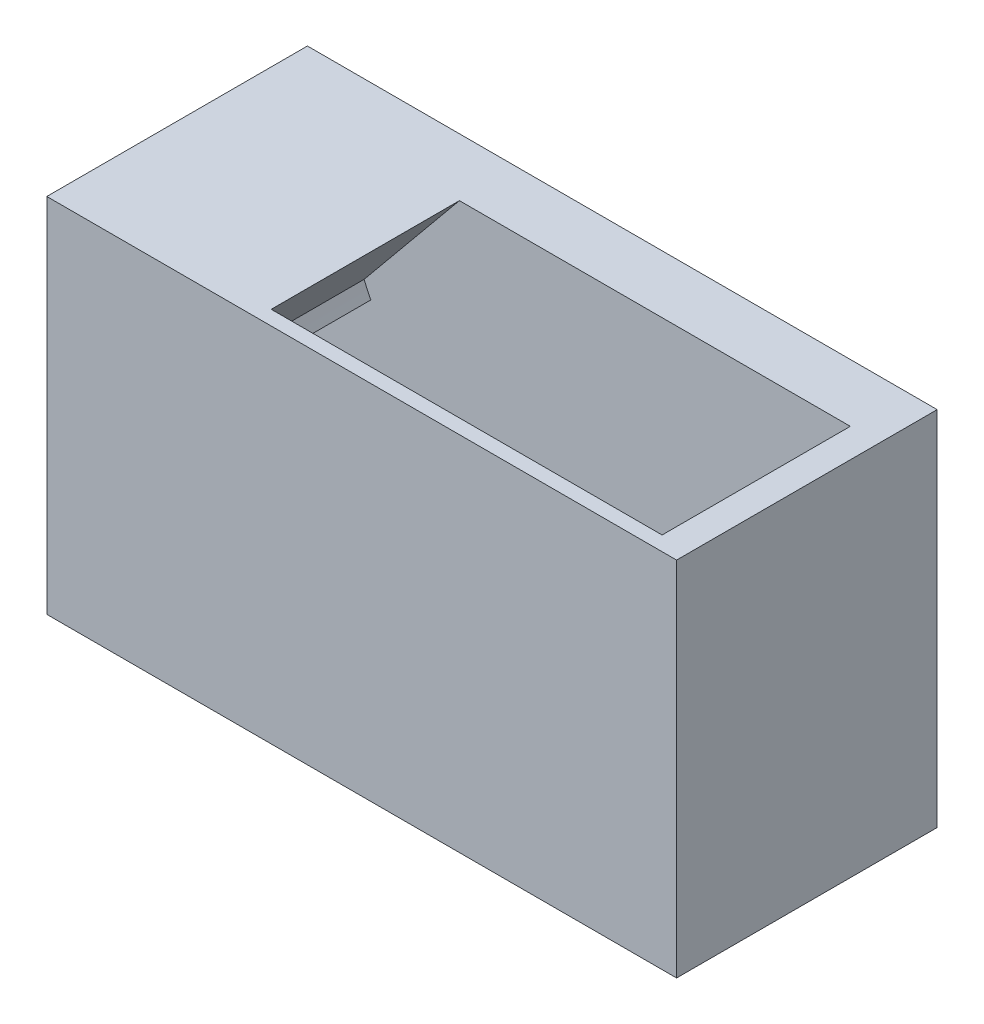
SolidWorks part; units mm, degrees
ref_plane "Plan de face" through (0, 0, 0) normal (0, 0, 1) x (1, 0, 0)
ref_plane "Plan de dessus" through (0, 0, 0) normal (0, 1, 0) x (1, 0, 0)
ref_plane "Plan de droite" through (0, 0, 0) normal (1, 0, 0) x (0, 0, -1)
sketch "Esquisse2" plane through (0, 0, 0) normal (0, 1, 0) x (1, 0, 0)
  line L0 (-217.5, -90) -> (217.5, 90) construction
  line L1 (-217.5, 90) -> (217.5, 90)
  line L2 (-217.5, 90) -> (-217.5, -90)
  line L3 (-217.5, -90) -> (217.5, -90)
  line L4 (217.5, 90) -> (217.5, -90)
  dimension "D1" = 435
  dimension "D2" = 180
extrude "Extrusion1" add sketch "Esquisse2" along normal mid plane 250
sketch "Esquisse3" plane through (0, -125, 0) normal (0, -1, 0) x (1, 0, 0)
  line L0 (-217.5, -90) -> (-217.5, 90) construction
  line L1 (-184.5, 76) -> (-57.5, 76)
  line L2 (-184.5, 76) -> (-184.5, -50)
  line L3 (-184.5, -50) -> (-57.5, -50)
  line L4 (-57.5, 76) -> (-57.5, -50)
  line L5 (67.5, 76) -> (197.5, 76)
  line L6 (67.5, 76) -> (67.5, -50)
  line L7 (67.5, -50) -> (197.5, -50)
  line L8 (197.5, 76) -> (197.5, -50)
  line L9 (307.8655, 122.6501) -> (282.1886, 122.6501)
  line L10 (307.8655, 122.6501) -> (307.8655, 145.3866)
  line L11 (307.8655, 145.3866) -> (282.1886, 145.3866)
  line L12 (282.1886, 122.6501) -> (282.1886, 145.3866)
  line L13 (217.5, 90) -> (217.5, -90) construction
  line L14 (217.5, -90) -> (-217.5, -90) construction
  line L15 (-217.5, 90) -> (217.5, 90) construction
  dimension "D1" = 33
  dimension "D2" = 20
  dimension "D3" = 40
  dimension "D4" = 14
  dimension "D5" = 160
  dimension "D6" = 150
extrude "Enlèv. mat.-Extru.1" cut sketch "Esquisse3" against normal blind 160
sketch "Esquisse4" plane through (0, 0, 0) normal (0, 0, 1) x (1, 0, 0)
  line L0 (-217.5, 125) -> (217.5, 125) construction
  line L2 (197.5, 125) -> (138.3329, 45)
  line L3 (217.5, 125) -> (217.5, -125) construction
  line L4 (-217.5, 125) -> (-217.5, -125) construction
  line L5 (-72.5, 125) -> (-138.3329, 45)
  line L6 (-72.5, 125) -> (197.5, 125)
  arc A0 (-138.3329, 45) -> (138.3329, 45) centre (0, 103) ccw
  dimension "D2" = 300
  dimension "D4" = 20
  dimension "D1" = 22
  dimension "D3" = 80
  dimension "D5" = 145
extrude "Enlèv. mat.-Extru.2" cut sketch "Esquisse4" against normal blind 50 and the other way blind 80
